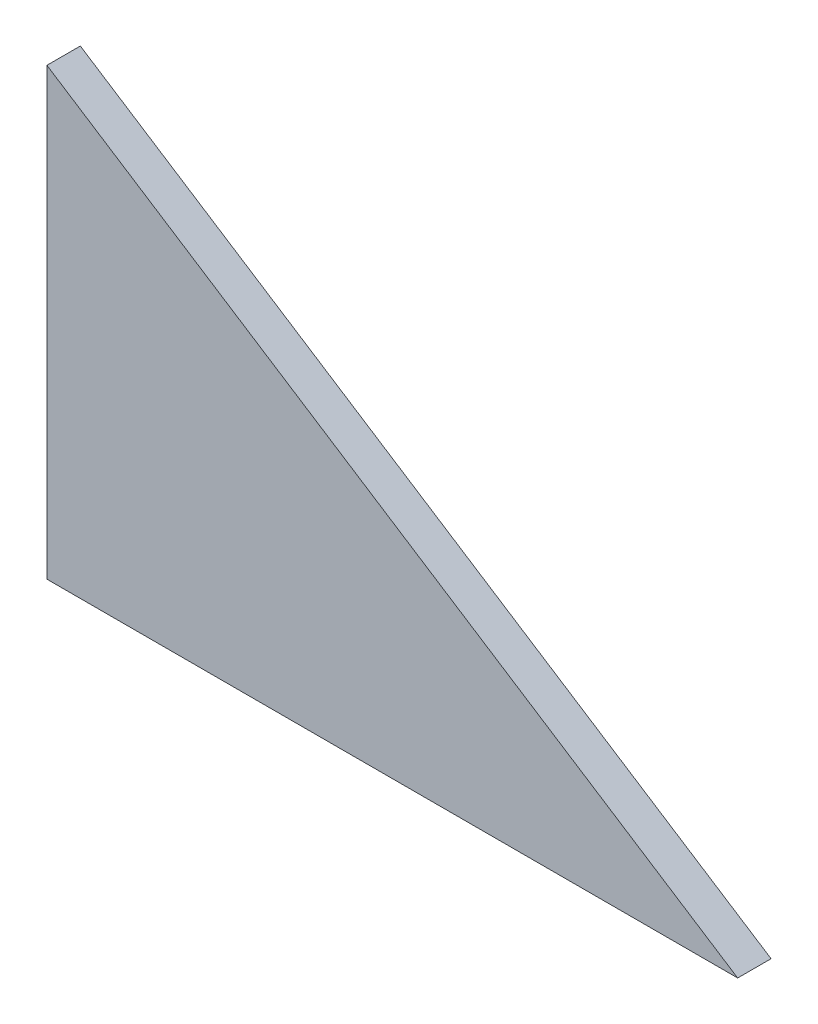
SolidWorks part; units mm, degrees
ref_plane "Piano frontale" through (0, 0, 0) normal (0, 0, 1) x (1, 0, 0)
ref_plane "Piano superiore" through (0, 0, 0) normal (0, 1, 0) x (1, 0, 0)
ref_plane "Piano destro" through (0, 0, 0) normal (1, 0, 0) x (0, 0, -1)
sketch "Sketch1" plane through (0, 0, 0) normal (0, 0, 1) x (1, 0, 0)
  line L0 (-49.8422, -29.3897) -> (74.2478, -29.3897)
  line L1 (-49.8422, -29.3897) -> (-49.8422, 50.5603)
  line L2 (-49.8422, 50.5603) -> (74.2478, -29.3897)
  dimension "D1" = 124.09
  dimension "D2" = 79.95
  dimension "D3" = 147.6155
extrude "Boss-Extrude1" add sketch "Sketch1" along normal blind 6
